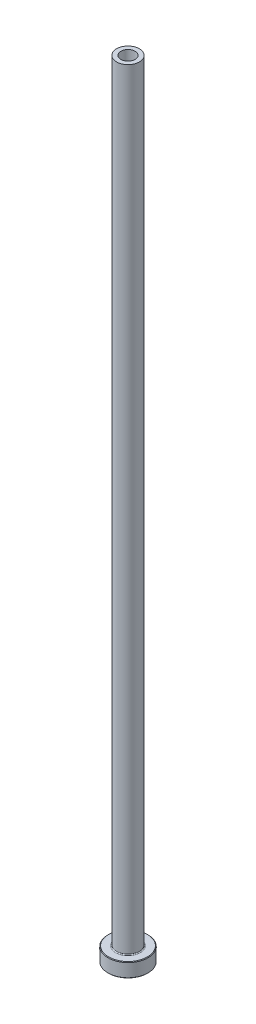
SolidWorks part; units mm, degrees
ref_plane "Front Plane" through (0, 0, 0) normal (0, 0, 1) x (1, 0, 0)
ref_plane "Top Plane" through (0, 0, 0) normal (0, 1, 0) x (1, 0, 0)
ref_plane "Right Plane" through (0, 0, 0) normal (1, 0, 0) x (0, 0, -1)
sketch "Sketch1" plane through (0, 0, 0) normal (0, 0, 1) x (1, 0, 0)
  line L0 (-2.5, 275) -> (-4, 275)
  line L1 (-4, 275) -> (-4, 5)
  line L2 (-4, 5) -> (-7, 5)
  line L3 (-7, 5) -> (-7, 0)
  line L4 (7.7, 0) -> (-7.7, 0) construction
  line L5 (-7, 0) -> (-2.75, 0)
  line L6 (-2.5, 230) -> (-2.5, 275)
  line L7 (0, 92.1877) -> (0, -15.5353) construction
  line L8 (0, -7.7) -> (0, 7.7) construction
  line L9 (-2.5, 230) -> (-2.75, 218)
  line L10 (-2.75, 218) -> (-2.75, 0)
  dimension "D1" = 0.25
  dimension "ID" = 5
  dimension "OD" = 8
  dimension "L" = 275
  dimension "H" = 14
  dimension "T" = 5
  dimension "N" = 45
  dimension "D2" = 12
revolve "Revolve1" add sketch "Sketch1" angle 360 about L7
fillet "Fillet1" radius 0.3 1 edges at (0, 5, 4)
chamfer "Chamfer1" distance 0.2 angle 45 2 edges at (0, 5, 7) (0, 0, 7)
chamfer "Chamfer3" distance 0.5 angle 45 1 edges at (0, 0, 2.75)
